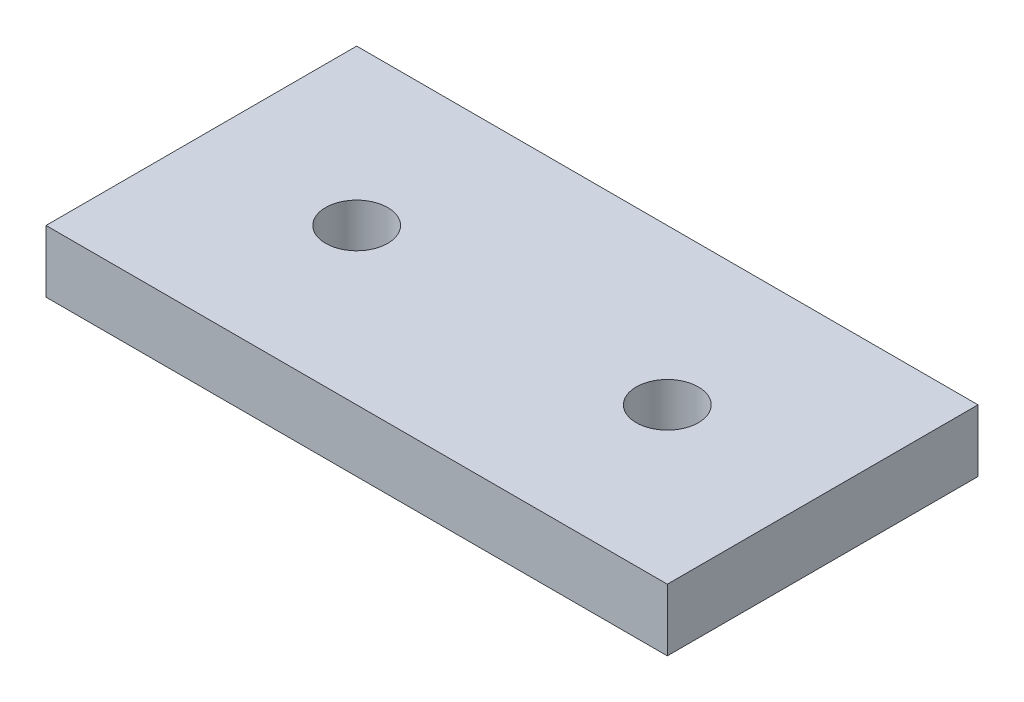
SolidWorks part; units mm, degrees
ref_plane "Front Plane" through (0, 0, 0) normal (0, 0, 1) x (1, 0, 0)
ref_plane "Top Plane" through (0, 0, 0) normal (0, 1, 0) x (1, 0, 0)
ref_plane "Right Plane" through (0, 0, 0) normal (1, 0, 0) x (0, 0, -1)
sketch "Sketch1" plane through (0, 0, 0) normal (0, 1, 0) x (1, 0, 0)
  line L1 (-50, 25) -> (50, 25)
  line L2 (-50, 25) -> (-50, -25)
  line L3 (-50, -25) -> (50, -25)
  line L4 (50, 25) -> (50, -25)
  line L5 (-50, 25) -> (50, -25) construction
  line L6 (-50, -25) -> (50, 25) construction
  point P0 (0, 0)
  dimension "D1" = 50
  dimension "D2" = 100
extrude "Boss-Extrude1" add sketch "Sketch1" along normal blind 10
sketch "Sketch2" plane through (0, 10, 0) normal (0, 1, 0) x (1, 0, 0)
  line L0 (-50, 0) -> (-25, 0) construction
  line L1 (-50, 25) -> (-50, -25) construction
  line L2 (0, 0) -> (0, -13.8136) construction
  circle A0 centre (-25, 0) radius 5
  circle A1 centre (25, 0) radius 5
  dimension "D2" = 10
  dimension "D1" = 25
extrude "Cut-Extrude1" cut sketch "Sketch2" against normal blind 10
sketch "Sketch3" plane through (-50, 0, 0) normal (-1, 0, 0) x (0, 0, 1)
  line L0 (25, 5) -> (-25, 5) construction
  line L1 (25, 10) -> (25, 0) construction
  line L2 (-25, 10) -> (-25, 0) construction
sketch "Sketch4" plane through (50, 0, 0) normal (1, 0, 0) x (0, 0, -1)
  line L0 (-25, 5) -> (25, 5) construction
  line L1 (-25, 5) -> (25, 5)
